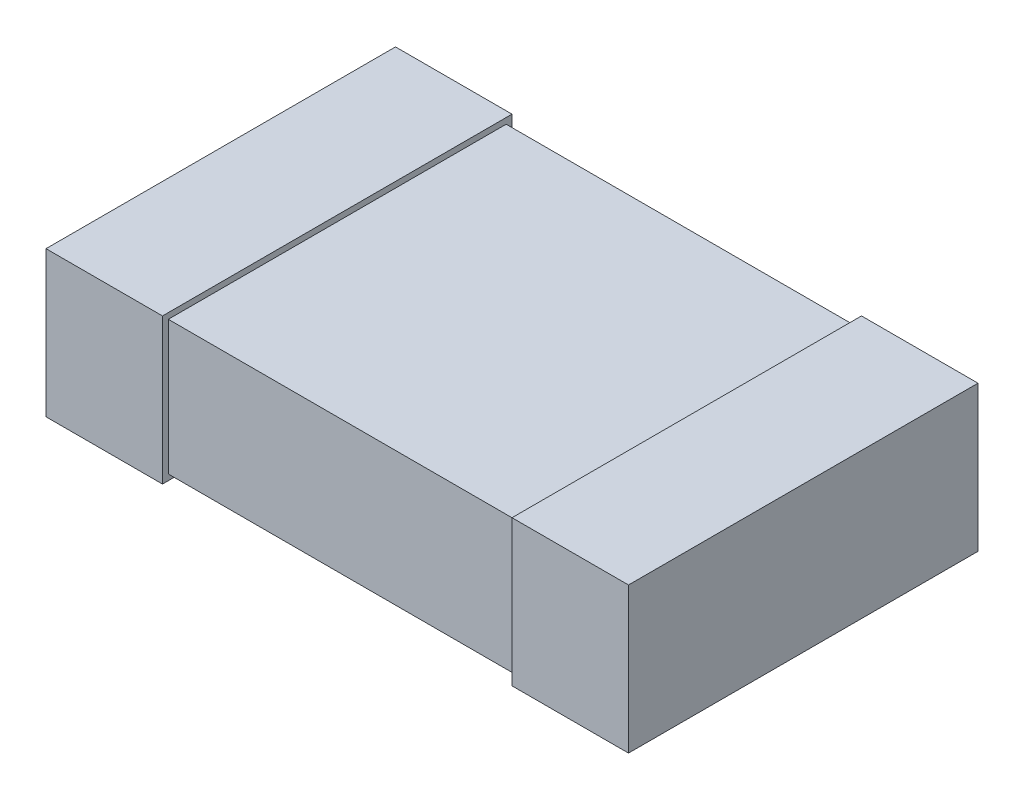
SolidWorks part; units mm, degrees
ref_plane "Front" through (0, 0, 0) normal (0, 0, 1) x (1, 0, 0)
ref_plane "Top" through (0, 0, 0) normal (0, 1, 0) x (1, 0, 0)
ref_plane "Right" through (0, 0, 0) normal (1, 0, 0) x (0, 0, -1)
sketch "Эскиз1" plane through (0, 0, 0) normal (0, 1, 0) x (1, 0, 0)
  line L0 (0, -0.6) -> (0, 0.6) construction
  line L1 (-1, -0.6) -> (-0.6, -0.6)
  line L2 (-1, -0.6) -> (-1, 0.6)
  line L3 (-1, 0.6) -> (-0.6, 0.6)
  line L4 (-0.6, -0.6) -> (-0.6, 0.6)
  line L5 (0.6, -0.6) -> (0.6, 0.6)
  line L6 (1, 0.6) -> (0.6, 0.6)
  line L7 (1, -0.6) -> (1, 0.6)
  line L8 (1, -0.6) -> (0.6, -0.6)
  dimension "W" = 1.2
  dimension "L" = 2
  dimension "L2" = 0.4
extrude "Вытянуть1" add sketch "Эскиз1" along normal blind 0.5
sketch "Эскиз2" plane through (-0.6, 0, 0) normal (1, 0, 0) x (0, 0, -1)
  line L0 (-0.58, 0.02) -> (0.58, 0.02)
  line L1 (0.58, 0.02) -> (0.58, 0.48)
  line L2 (0.58, 0.48) -> (-0.58, 0.48)
  line L3 (-0.58, 0.48) -> (-0.58, 0.02)
  line L4 (-0.6, 0) -> (0.6, 0)
  line L5 (0.6, 0) -> (0.6, 0.5)
  line L6 (0.6, 0.5) -> (-0.6, 0.5)
  line L7 (-0.6, 0.5) -> (-0.6, 0)
  line L8 (-0.6, 0) -> (0.6, 0) construction
  line L9 (0.6, 0) -> (0.6, 0.5) construction
  line L10 (0.6, 0.5) -> (-0.6, 0.5) construction
  line L11 (-0.6, 0.5) -> (-0.6, 0) construction
  dimension "D1" = 0
  dimension "D2" = 0.02
extrude "Вытянуть2" add sketch "Эскиз2" along normal up to surface (1.2 mm away)
